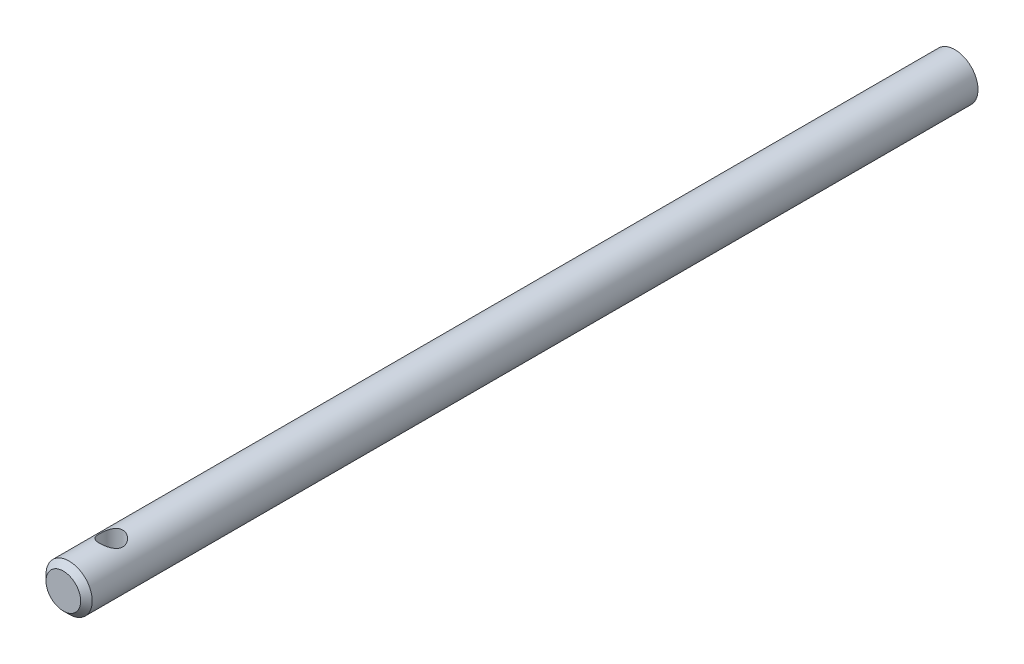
SolidWorks part; units mm, degrees
ref_plane "Plan1" through (0, 0, 0) normal (0, 0, 1) x (1, 0, 0)
ref_plane "Plan2" through (0, 0, 0) normal (0, 1, 0) x (1, 0, 0)
ref_plane "Plan3" through (0, 0, 0) normal (1, 0, 0) x (0, 0, -1)
imported_body "Importée1"
sketch "Esquisse1" plane through (0, 0, 43.7) normal (0, 0, 1) x (1, 0, 0)
  circle A0 centre (0, 0) radius 8
  dimension "D1" = 16
extrude "Boss.-Extru.1" add sketch "Esquisse1" along normal blind 35
chamfer "Chanfrein1" distance 2 angle 45
ref_plane "Plan4" through (0, 8, 0) normal (0, 1, 0) x (-1, 0, 0)
sketch "Esquisse2" plane through (0, 8, 0) normal (0, 1, 0) x (-1, 0, 0)
  line L0 (6, 78.7) -> (-6, 78.7) construction
  circle A0 centre (0, 62.12) radius 4
  dimension "D1" = 8
  dimension "D2" = 16.58
extrude "Enlèv. mat.-Extru.1" cut sketch "Esquisse2" against normal through all
